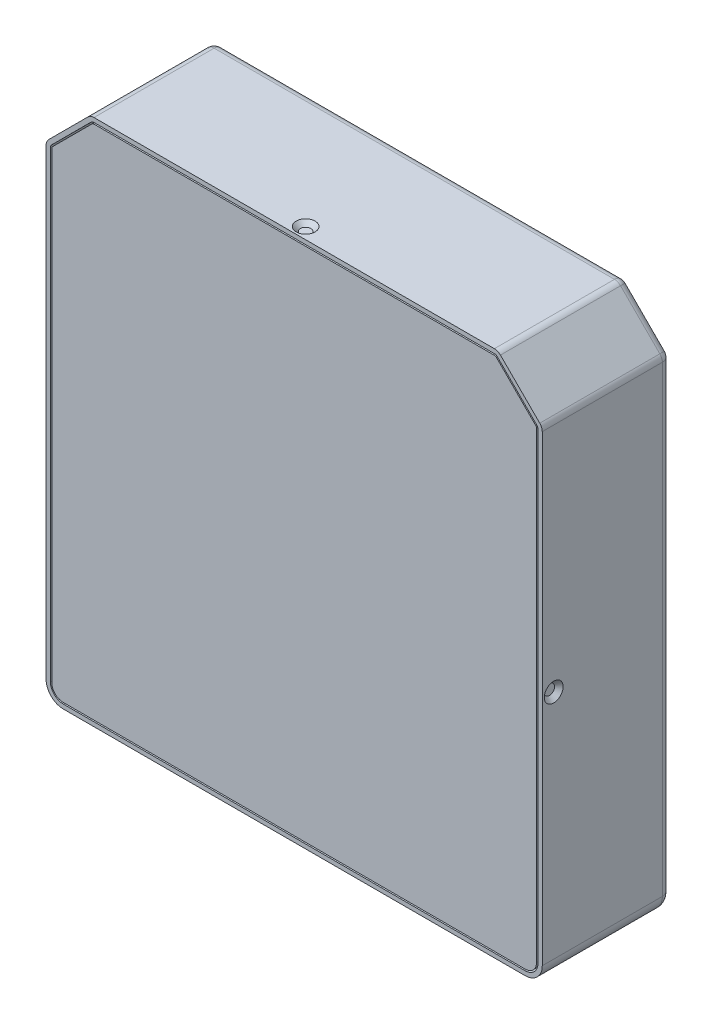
SolidWorks part; units mm, degrees
ref_plane "前视基准面" through (0, 0, 0) normal (0, 0, 1) x (1, 0, 0)
ref_plane "上视基准面" through (0, 0, 0) normal (0, 1, 0) x (1, 0, 0)
ref_plane "右视基准面" through (0, 0, 0) normal (1, 0, 0) x (0, 0, -1)
sketch "草图1" plane through (0, 0, 0) normal (0, 0, 1) x (1, 0, 0)
  line B0 (-80.75, 0) -> (80.75, 0)
  line B1 (86.75, 6) -> (86.75, 167.7574)
  line B2 (85.8713, 169.8787) -> (72.1287, 183.6213)
  line B3 (70.0074, 184.5) -> (-70.0074, 184.5)
  line B4 (-72.1287, 183.6213) -> (-85.8713, 169.8787)
  line B5 (-86.75, 167.7574) -> (-86.75, 6)
  arc B6 (80.75, 0) -> (86.75, 6) centre (80.75, 6) ccw
  arc B7 (86.75, 167.7574) -> (85.8713, 169.8787) centre (83.75, 167.7574) ccw
  arc B8 (72.1287, 183.6213) -> (70.0074, 184.5) centre (70.0074, 181.5) ccw
  arc B9 (-70.0074, 184.5) -> (-72.1287, 183.6213) centre (-70.0074, 181.5) ccw
  arc B10 (-85.8713, 169.8787) -> (-86.75, 167.7574) centre (-83.75, 167.7574) ccw
  arc B11 (-86.75, 6) -> (-80.75, 0) centre (-80.75, 6) ccw
sketch_block_instance "块1-1"
sketch_block "块1"
extrude "凸台-拉伸1" add sketch "草图1" along normal blind 45
fillet "圆角1" radius 3 12 edges at (0, 0, 0) (84.9926, 1.7574, 0) (86.75, 86.8787, 0) (86.5216, 168.9054, 0) (79, 176.75, 0) (71.1554, 184.2716, 0) (0, 184.5, 0) (-71.1554, 184.2716, 0) (-79, 176.75, 0) (-86.5216, 168.9054, 0) (-86.75, 86.8787, 0) (-84.9926, 1.7574, 0)
shell "抽壳1" thickness 1.5
hole_wizard "打孔尺寸(%根据十字)槽半沉头木螺钉的类型1" positions "草图2" profile "草图3" countersink size "M3" standard "GB"
sketch "草图2" plane through (-86.75, 0, 0) normal (-1, 0, 0) x (0, 0, 1)
  line L0 (45, 167.7574) -> (45, 6) construction
  line L1 (41, 86.8787) -> (45, 86.8787) construction
  point P0 (41, 86.8787)
  dimension "D1" = 4
sketch "草图3" plane through (-86.75, 86.8787, 41) normal (0, 1, 0) x (0, 0, 1)
  line L0 (0, 0) -> (0, 16.7715)
  line L1 (0, 16.7715) -> (1.7, 15.75)
  line L2 (1.7, 15.75) -> (1.7, 1.6)
  line L3 (1.7, 1.6) -> (3.3, 0)
  line L5 (3.3, 0) -> (0, 0)
  line L6 (-1.7, 1.6) -> (-3.3, 0) construction
  line L10 (0, 16.7715) -> (-1.7, 15.75) construction
  line L11 (0, -6.35) -> (0, 107.95) construction
  dimension "孔直径" = 3.4
  dimension "孔深度" = 15.75
  dimension "近端锥形沉头孔直径" = 6.6
  dimension "近端锥形沉头孔角度" = 90
  dimension "导头角度" = 118
mirror "镜向1" about plane through (0, 0, 0) normal (1, 0, 0) of "打孔尺寸(%根据十字)槽半沉头木螺钉的类型1"
hole_wizard "打孔尺寸(%根据十字)槽半沉头木螺钉的类型2" positions "草图4" profile "草图5" countersink size "M3" standard "GB"
sketch "草图4" plane through (0, 184.5, 0) normal (0, 1, 0) x (1, 0, 0)
  line L0 (70.0074, -45) -> (-70.0074, -45) construction
  point P0 (0, -41)
  dimension "D1" = 4
sketch "草图5" plane through (0, 184.5, 41) normal (1, 0, 0) x (0, 0, 1)
  line L0 (0, 0) -> (0, 16.7715)
  line L1 (0, 16.7715) -> (1.7, 15.75)
  line L2 (1.7, 15.75) -> (1.7, 1.6)
  line L3 (1.7, 1.6) -> (3.3, 0)
  line L5 (3.3, 0) -> (0, 0)
  line L6 (-1.7, 1.6) -> (-3.3, 0) construction
  line L10 (0, 16.7715) -> (-1.7, 15.75) construction
  line L11 (0, -6.35) -> (0, 107.95) construction
  dimension "孔直径" = 3.4
  dimension "孔深度" = 15.75
  dimension "近端锥形沉头孔直径" = 6.6
  dimension "近端锥形沉头孔角度" = 90
  dimension "导头角度" = 118
hole_wizard "打孔尺寸(%根据十字)槽半沉头木螺钉的类型3" positions "草图6" profile "草图7" countersink size "M3" standard "GB"
sketch "草图6" plane through (0, 0, 0) normal (0, -1, 0) x (-1, 0, 0)
  point P0 (0, -41)
  point P4 (0, -41)
  point P6 (0, -41)
sketch "草图7" plane through (0, 0, 41) normal (1, 0, 0) x (0, 0, -1)
  line L0 (0, 0) -> (0, 16.7715)
  line L1 (0, 16.7715) -> (1.7, 15.75)
  line L2 (1.7, 15.75) -> (1.7, 1.6)
  line L3 (1.7, 1.6) -> (3.3, 0)
  line L5 (3.3, 0) -> (0, 0)
  line L6 (-1.7, 1.6) -> (-3.3, 0) construction
  line L10 (0, 16.7715) -> (-1.7, 15.75) construction
  line L11 (0, -6.35) -> (0, 107.95) construction
  dimension "孔直径" = 3.4
  dimension "孔深度" = 15.75
  dimension "近端锥形沉头孔直径" = 6.6
  dimension "近端锥形沉头孔角度" = 90
  dimension "导头角度" = 118
sketch "草图9" plane through (0, 0, 45) normal (0, 0, 1) x (1, 0, 0)
  line L12 (-80.75, 2) -> (80.75, 2)
  line L13 (84.75, 6) -> (84.75, 167.7574)
  line L14 (84.4571, 168.4645) -> (70.7145, 182.2071)
  line L15 (70.0074, 182.5) -> (-70.0074, 182.5)
  line L16 (-70.7145, 182.2071) -> (-84.4571, 168.4645)
  line L17 (-84.75, 167.7574) -> (-84.75, 6)
  line L18 (-80.75, 2) -> (80.75, 2)
  line L19 (84.75, 6) -> (84.75, 167.7574)
  line L20 (84.4571, 168.4645) -> (70.7145, 182.2071)
  line L21 (70.0074, 182.5) -> (-70.0074, 182.5)
  line L22 (-70.7145, 182.2071) -> (-84.4571, 168.4645)
  line L23 (-84.75, 167.7574) -> (-84.75, 6)
  arc A12 (-84.75, 6) -> (-80.75, 2) centre (-80.75, 6) ccw
  arc A13 (80.75, 2) -> (84.75, 6) centre (80.75, 6) ccw
  arc A14 (84.75, 167.7574) -> (84.4571, 168.4645) centre (83.75, 167.7574) ccw
  arc A15 (70.7145, 182.2071) -> (70.0074, 182.5) centre (70.0074, 181.5) ccw
  arc A16 (-70.0074, 182.5) -> (-70.7145, 182.2071) centre (-70.0074, 181.5) ccw
  arc A17 (-84.4571, 168.4645) -> (-84.75, 167.7574) centre (-83.75, 167.7574) ccw
  arc A18 (-84.75, 6) -> (-80.75, 2) centre (-80.75, 6) ccw
  arc A19 (80.75, 2) -> (84.75, 6) centre (80.75, 6) ccw
  arc A20 (84.75, 167.7574) -> (84.4571, 168.4645) centre (83.75, 167.7574) ccw
  arc A21 (70.7145, 182.2071) -> (70.0074, 182.5) centre (70.0074, 181.5) ccw
  arc A22 (-70.0074, 182.5) -> (-70.7145, 182.2071) centre (-70.0074, 181.5) ccw
  arc A23 (-84.4571, 168.4645) -> (-84.75, 167.7574) centre (-83.75, 167.7574) ccw
  dimension "D1" = 2
extrude "凸台-拉伸2" add sketch "草图9" against normal blind 12 separate body
